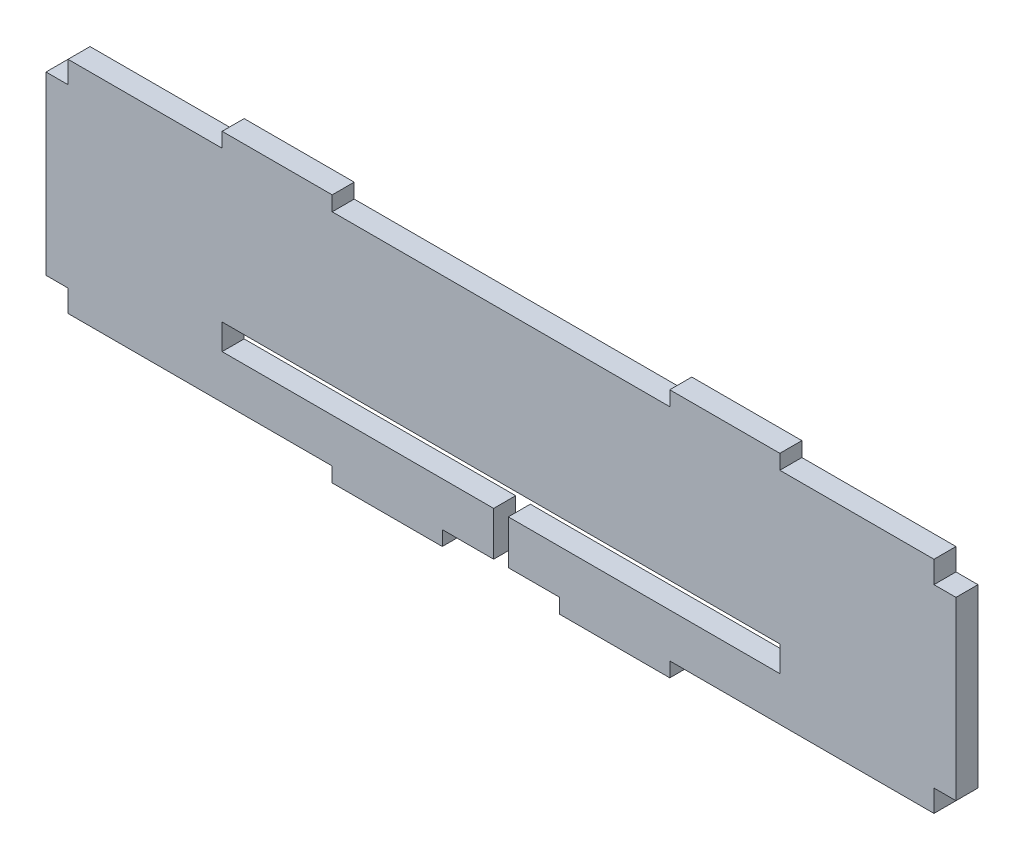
SolidWorks part; units mm, degrees
ref_plane "Front Plane" through (0, 0, 0) normal (0, 0, 1) x (1, 0, 0)
ref_plane "Top Plane" through (0, 0, 0) normal (0, 1, 0) x (1, 0, 0)
ref_plane "Right Plane" through (0, 0, 0) normal (1, 0, 0) x (0, 0, -1)
sketch "Sketch1" plane through (0, 0, 0) normal (0, 0, 1) x (1, 0, 0)
  line L0 (0, 0) -> (0, 43717.3993) construction
  line L1 (-5.9695, 0) -> (43711.4297, 0) construction
  line L2 (3, 0) -> (42, 0)
  line L4 (3, 0) -> (3, 30)
  line L6 (127, 0) -> (127, 30)
  line L7 (42, 0) -> (42, -2)
  line L8 (42, -2) -> (57, -2)
  line L9 (57, -2) -> (57, 0)
  line L10 (57, 0) -> (73, 0)
  line L11 (73, 0) -> (73, -2)
  line L12 (73, -2) -> (88, -2)
  line L13 (88, -2) -> (88, 0)
  line L14 (88, 0) -> (127, 0)
  line L15 (65, 0) -> (65, -50000) construction
  line L16 (27, 9.5) -> (103, 9.5)
  line L17 (27, 9.5) -> (27, 6)
  line L19 (103, 9.5) -> (103, 6)
  line L20 (66, 0) -> (66, 6)
  line L21 (64, 0) -> (66, 0)
  line L22 (64, 0) -> (64, 6)
  line L25 (27, 6) -> (64, 6)
  line L26 (66, 6) -> (103, 6)
  line L27 (3, 30) -> (27, 30)
  line L29 (42, 30) -> (42, 32)
  line L30 (42, 32) -> (27, 32)
  line L31 (27, 30) -> (27, 32)
  line L32 (42, 30) -> (88, 30)
  line L33 (127, 30) -> (103, 30)
  line L34 (103, 30) -> (103, 32)
  line L35 (88, 32) -> (103, 32)
  line L36 (88, 30) -> (88, 32)
  line L37 (127, 3) -> (124, 3)
  line L38 (3, 0) -> (6, 0)
  line L39 (3, 0) -> (3, 3)
  line L40 (3, 3) -> (6, 3)
  line L41 (6, 0) -> (6, 3)
  line L42 (124, 0) -> (124, 3)
  line L43 (127, 0) -> (124, 0)
  line L44 (127, 0) -> (127, 3)
  line L45 (-14.82, 15) -> (49985.18, 15) construction
  line L46 (127, 30) -> (124, 30)
  line L47 (124, 30) -> (124, 27)
  line L48 (127, 27) -> (124, 27)
  line L49 (127, 30) -> (127, 27)
  line L50 (3, 27) -> (6, 27)
  line L51 (6, 30) -> (6, 27)
  line L52 (3, 30) -> (6, 30)
  line L53 (3, 30) -> (3, 27)
  point P36 (65, 30)
  dimension "D1" = 124
  dimension "D2" = 30
  dimension "D3" = 15
  dimension "D4" = 15
  dimension "D5" = 16
  dimension "D6" = 15
  dimension "D7" = 2
  dimension "D8" = 2
  dimension "D9" = 15
  dimension "D10" = 15
  dimension "D11" = 6
  dimension "D12" = 3.5
  dimension "D13" = 15
  dimension "D14" = 2
  dimension "D16" = 15
  dimension "D17" = 3
  dimension "D18" = 3
  dimension "D19" = 46
extrude "Boss-Extrude3" add sketch "Sketch1" along normal blind 3 contours L36 L32 L29 L30 L31 L27 L4 L2 L7 L8 L9 L10 L22 L25 L17 L16 L19 L26 L20 L11 L12 L13 L14 L6 L33 L34 L35
